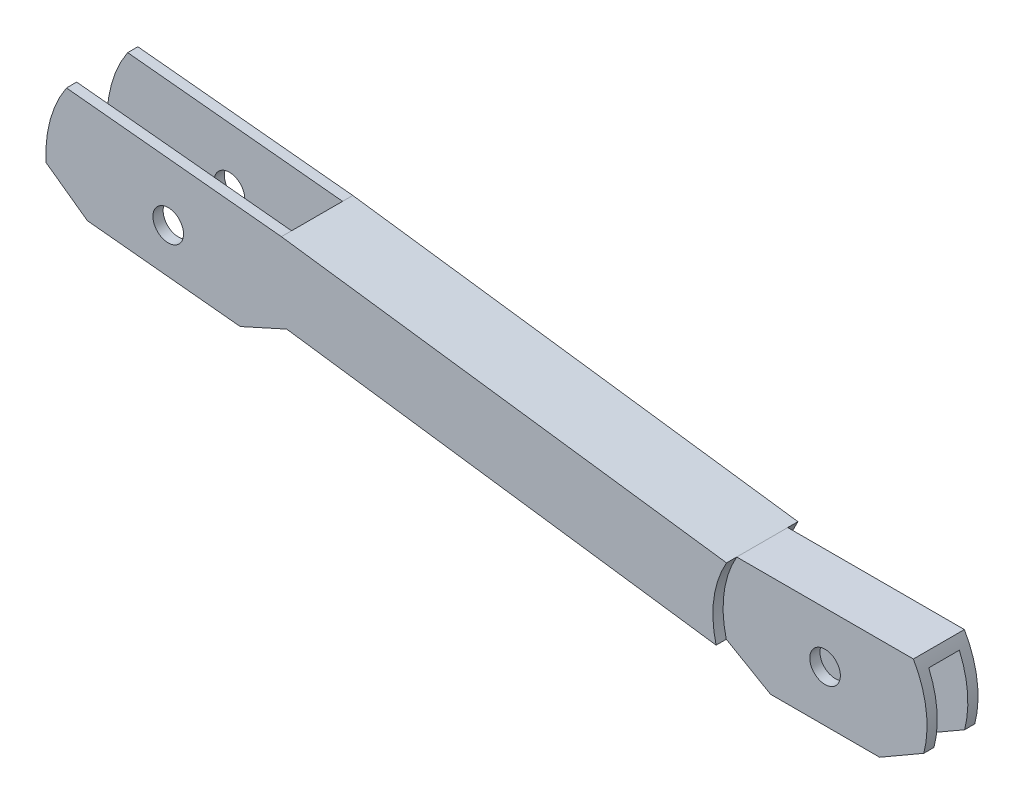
SolidWorks part; units mm, degrees
ref_plane "Plan de face" through (0, 0, 0) normal (0, 0, 1) x (1, 0, 0)
ref_plane "Plan de dessus" through (0, 0, 0) normal (0, 1, 0) x (1, 0, 0)
ref_plane "Plan de droite" through (0, 0, 0) normal (1, 0, 0) x (0, 0, -1)
sketch "Esquisse de base" plane through (0, 0, 0) normal (0, 0, 1) x (1, 0, 0)
  line L0 (-634, 63) -> (0, 0) construction
  point P0 (0, 0)
  point P1 (-634, 63)
  dimension "D1" = 634
  dimension "D2" = 63
sketch "Esquisse1" plane through (0, 0, 0) normal (0, 0, 1) x (1, 0, 0)
  line L0 (0, 36.8381) -> (0, -52.9277) construction
  line L1 (-105.2631, 0) -> (73.8327, 0) construction
  line L2 (-86.6025, 50) -> (86.6025, 50)
  line L3 (-96.8246, -25) -> (-53.5233, -50)
  line L4 (-53.5233, -50) -> (53.5233, -50)
  line L5 (96.8246, -25) -> (53.5233, -50)
  circle A0 centre (0, 0) radius 15
  arc A1 (-86.6025, 50) -> (-96.8246, -25) centre (0, 0) ccw
  arc A2 (96.8246, -25) -> (86.6025, 50) centre (0, 0) ccw
  dimension "D1" = 30
  dimension "D2" = 100
  dimension "D3" = 30
  dimension "D4" = 100
  dimension "D5" = 25
extrude "Boss.-Extru.1" add sketch "Esquisse1" along normal mid plane 50
sketch "Esquisse2" plane through (0, 0, 0) normal (0, 0, 1) x (1, 0, 0)
  line L0 (-96.8246, -25) -> (-53.5233, -50) construction
  line L1 (-53.5233, -50) -> (53.5233, -50) construction
  line L2 (53.5233, -50) -> (96.8246, -25) construction
  line L3 (-96.8246, -25) -> (-53.5233, -50)
  line L4 (-53.5233, -50) -> (53.5233, -50)
  line L5 (53.5233, -50) -> (96.8246, -25)
  line L6 (-91.6515, 40) -> (91.6515, 40)
  line L7 (86.6025, 50) -> (-86.6025, 50) construction
  arc A0 (-86.6025, 50) -> (-96.8246, -25) centre (0, 0) ccw construction
  arc A1 (96.8246, -25) -> (86.6025, 50) centre (0, 0) ccw construction
  arc A2 (-91.6515, 40) -> (-96.8246, -25) centre (0, 0) ccw
  arc A3 (96.8246, -25) -> (91.6515, 40) centre (0, 0) ccw
  dimension "D1" = 10
extrude "Enlèv. mat.-Extru.1" cut sketch "Esquisse2" against normal mid plane 30
sketch "Esquisse3" plane through (0, 0, 0) normal (0, 0, 1) x (1, 0, 0)
  line L0 (-733.761, 129.6914) -> (-523.0653, 108.7548)
  line L1 (-634, 63) -> (0, 0) construction
  line L2 (-713.1966, 27.1555) -> (-563.4061, 12.2709)
  line L3 (-713.1966, 27.1555) -> (-753.8136, 56.3147)
  line L4 (-909.6175, 147.1661) -> (-311.0486, 87.6869) construction
  line L5 (-919.5057, 47.6562) -> (-320.9368, -11.823) construction
  line L6 (-638.3014, 19.7132) -> (-611.8937, 285.4661) construction
  line L7 (-563.4061, 12.2709) -> (-517.845, 32.8667)
  circle A0 centre (-634, 63) radius 15
  arc A1 (-733.761, 129.6914) -> (-753.8136, 56.3147) centre (-634, 63) ccw
  arc A2 (-517.845, 32.8667) -> (-523.0653, 108.7548) centre (-634, 63) ccw
  dimension "D1" = 30
  dimension "D2" = 240
  dimension "D3" = 100
  dimension "D4" = 56.5
  dimension "D5" = 30
  dimension "D6" = 50
extrude "Boss.-Extru.2" add sketch "Esquisse3" along normal mid plane 70 separate body
sketch "Esquisse4" plane through (0, 0, 0) normal (0, 0, 1) x (1, 0, 0)
  line L0 (-563.4061, 12.2709) -> (-517.845, 32.8667) construction
  line L1 (-733.761, 129.6914) -> (-523.0653, 108.7548) construction
  line L2 (-713.1966, 27.1555) -> (-753.8136, 56.3147) construction
  line L3 (-713.1966, 27.1555) -> (-563.4061, 12.2709) construction
  line L4 (-563.4061, 12.2709) -> (-517.845, 32.8667)
  line L5 (-733.761, 129.6914) -> (-523.0653, 108.7548)
  line L6 (-713.1966, 27.1555) -> (-753.8136, 56.3147)
  line L7 (-713.1966, 27.1555) -> (-563.4061, 12.2709)
  circle A0 centre (-634, 63) radius 15 construction
  arc A1 (-517.845, 32.8667) -> (-523.0653, 108.7548) centre (-634, 63) ccw construction
  arc A2 (-733.761, 129.6914) -> (-753.8136, 56.3147) centre (-634, 63) ccw construction
  circle A3 centre (-634, 63) radius 15
  arc A4 (-517.845, 32.8667) -> (-523.0653, 108.7548) centre (-634, 63) ccw
  arc A5 (-733.761, 129.6914) -> (-753.8136, 56.3147) centre (-634, 63) ccw
extrude "Enlèv. mat.-Extru.3" cut sketch "Esquisse4" against normal mid plane 50
sketch "Esquisse6" plane through (0, 0, 0) normal (0, 0, 1) x (1, 0, 0)
  line L0 (-523.0653, 108.7548) -> (-86.6025, 50)
  line L1 (-519.2643, 98.1529) -> (-91.4066, 40.5565)
  line L3 (-559.3822, 103.5534) -> (-41.6855, 33.8633) construction
  line L4 (-558.0481, 113.464) -> (-40.3514, 43.7739) construction
  arc A0 (-86.6025, 50) -> (-96.8246, -25) centre (0, 0) ccw construction
  arc A1 (-86.6025, 50) -> (-91.4066, 40.5565) centre (0, 0) ccw
  arc A2 (-517.845, 32.8667) -> (-523.0653, 108.7548) centre (-634, 63) ccw construction
  arc A3 (-519.2643, 98.1529) -> (-523.0653, 108.7548) centre (-634, 63) ccw
  dimension "D1" = 10
extrude "Boss.-Extru.4" add sketch "Esquisse6" along normal mid plane 50
sketch "Esquisse8" plane through (0, 0, 35) normal (0, 0, 1) x (1, 0, 0)
  line L0 (-86.6025, 50) -> (-523.0653, 108.7548) construction
  line L1 (-86.6025, 50) -> (-523.0653, 108.7548)
  line L2 (-517.845, 32.8667) -> (-96.8246, -25)
  arc A0 (-91.4066, 40.5565) -> (-96.8246, -25) centre (0, 0) ccw construction
  arc A1 (-86.6025, 50) -> (-96.8246, -25) centre (0, 0) ccw
  arc A2 (-517.845, 32.8667) -> (-523.0653, 108.7548) centre (-634, 63) ccw construction
  arc A3 (-517.845, 32.8667) -> (-523.0653, 108.7548) centre (-634, 63) ccw
extrude "Boss.-Extru.7" add sketch "Esquisse8" against normal blind 11
mirror "Symétrie1" about plane through (0, 0, 0) normal (0, 0, 1) of "Boss.-Extru.7"
fillet "Congé1" radius 10 2 edges at (-99.6602, 8.2365, -24) (-99.6602, 8.2365, 24)
